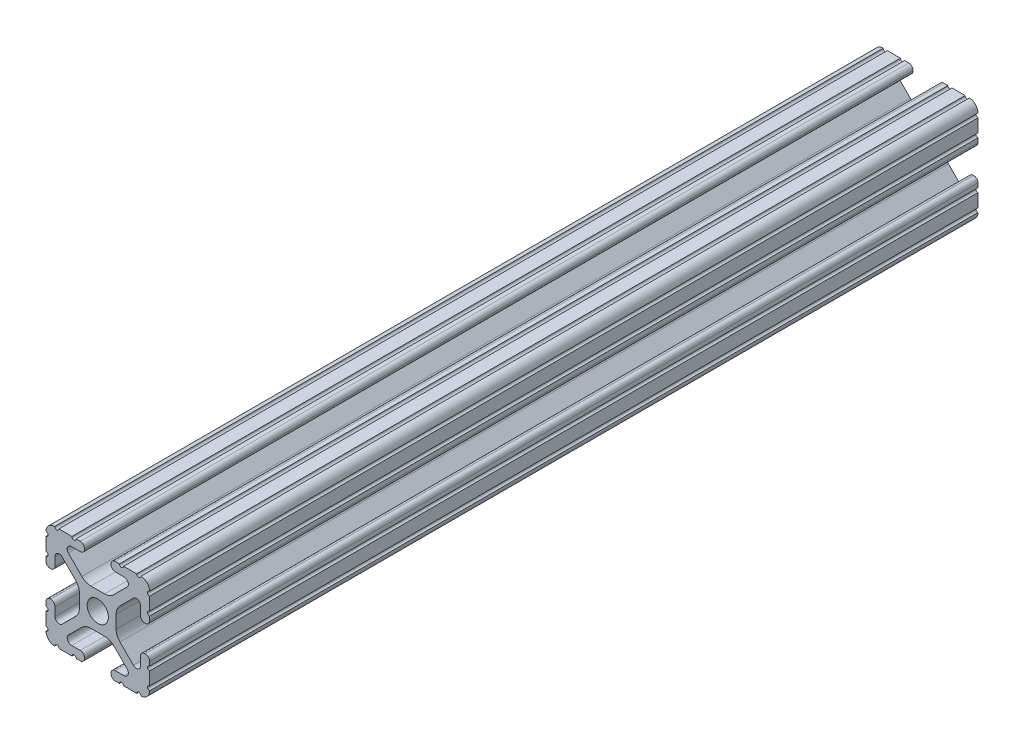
SolidWorks part; units mm, degrees
ref_plane "Front Plane" through (0, 0, 0) normal (0, 0, 1) x (1, 0, 0)
ref_plane "Top Plane" through (0, 0, 0) normal (0, 1, 0) x (1, 0, 0)
ref_plane "Right Plane" through (0, 0, 0) normal (1, 0, 0) x (0, 0, -1)
sketch "Sketch1" plane through (0, 0, 0) normal (0, 0, 1) x (1, 0, 0)
  line L88 (-7.1797, -8.6452) -> (-3.9523, -5.4237)
  line L89 (-1.7093, -4.4958) -> (1.7093, -4.4958)
  line L90 (3.9523, -5.4237) -> (7.1797, -8.6452)
  line L91 (6.4164, -10.4902) -> (4.2875, -10.4902)
  line L92 (3.2385, -11.5392) -> (3.2385, -11.651)
  line L93 (4.2875, -12.7) -> (5.3171, -12.7)
  line L94 (6.3331, -12.7) -> (9.5504, -12.7)
  line L95 (12.7, -9.5504) -> (12.7, -6.3331)
  line L96 (12.7, -5.3171) -> (12.7, -4.2875)
  line L97 (11.651, -3.2385) -> (11.5392, -3.2385)
  line L98 (10.4902, -4.2875) -> (10.4902, -6.4021)
  line L99 (8.7371, -7.1294) -> (5.441, -3.8408)
  line L100 (4.5085, -1.5932) -> (4.5085, 1.5932)
  line L101 (5.441, 3.8408) -> (8.7371, 7.1294)
  line L102 (10.4902, 6.4021) -> (10.4902, 4.2875)
  line L103 (11.5392, 3.2385) -> (11.651, 3.2385)
  line L104 (12.7, 4.2875) -> (12.7, 5.3171)
  line L105 (12.7, 6.3331) -> (12.7, 9.5504)
  line L106 (9.5504, 12.7) -> (6.3331, 12.7)
  line L107 (5.3171, 12.7) -> (4.2875, 12.7)
  line L108 (3.2385, 11.651) -> (3.2385, 11.5392)
  line L109 (4.2875, 10.4902) -> (6.4768, 10.4902)
  line L110 (7.207, 8.7244) -> (3.8983, 5.4232)
  line L111 (1.6558, 4.4958) -> (-1.6558, 4.4958)
  line L112 (-3.8983, 5.4232) -> (-7.207, 8.7244)
  line L113 (-6.4768, 10.4902) -> (-4.2875, 10.4902)
  line L114 (-3.2385, 11.5392) -> (-3.2385, 11.651)
  line L115 (-4.2875, 12.7) -> (-5.3171, 12.7)
  line L116 (-6.3331, 12.7) -> (-9.5504, 12.7)
  line L117 (-12.7, 9.5504) -> (-12.7, 6.3331)
  line L118 (-12.7, 5.3171) -> (-12.7, 4.2875)
  line L119 (-11.651, 3.2385) -> (-11.5392, 3.2385)
  line L120 (-10.4902, 4.2875) -> (-10.4902, 6.4021)
  line L121 (-8.7371, 7.1294) -> (-5.441, 3.8408)
  line L122 (-4.5085, 1.5932) -> (-4.5085, -1.5932)
  line L123 (-5.441, -3.8408) -> (-8.7371, -7.1294)
  line L124 (-10.4902, -6.4021) -> (-10.4902, -4.2875)
  line L125 (-11.5392, -3.2385) -> (-11.651, -3.2385)
  line L126 (-12.7, -4.2875) -> (-12.7, -5.3171)
  line L127 (-12.7, -6.3331) -> (-12.7, -9.5504)
  line L128 (-9.5504, -12.7) -> (-6.3331, -12.7)
  line L129 (-5.3171, -12.7) -> (-4.2875, -12.7)
  line L130 (-3.2385, -11.651) -> (-3.2385, -11.5392)
  line L131 (-4.2875, -10.4902) -> (-6.4164, -10.4902)
  circle A1 centre (0, 0) radius 2.6035
  arc A104 (-7.1797, -8.6452) -> (-6.4164, -10.4902) centre (-6.4164, -9.4098) ccw
  arc A105 (-1.7093, -4.4958) -> (-3.9523, -5.4237) centre (-1.7093, -7.6708) ccw
  arc A106 (3.9523, -5.4237) -> (1.7093, -4.4958) centre (1.7093, -7.6708) ccw
  arc A107 (6.4164, -10.4902) -> (7.1797, -8.6452) centre (6.4164, -9.4098) ccw
  arc A108 (4.2875, -10.4902) -> (3.2385, -11.5392) centre (4.2875, -11.5392) ccw
  arc A109 (3.2385, -11.651) -> (4.2875, -12.7) centre (4.2875, -11.651) ccw
  arc A110 (6.3331, -12.7) -> (5.3171, -12.7) centre (5.8251, -12.7) ccw
  arc A111 (10.5664, -12.6998) -> (9.5504, -12.7) centre (10.0584, -12.7) ccw
  arc A112 (10.5664, -12.6998) -> (12.6998, -10.5664) centre (10.5918, -10.5918) ccw
  arc A113 (12.7, -9.5504) -> (12.6998, -10.5664) centre (12.7, -10.0584) ccw
  arc A114 (12.7, -5.3171) -> (12.7, -6.3331) centre (12.7, -5.8251) ccw
  arc A115 (12.7, -4.2875) -> (11.651, -3.2385) centre (11.651, -4.2875) ccw
  arc A116 (11.5392, -3.2385) -> (10.4902, -4.2875) centre (11.5392, -4.2875) ccw
  arc A117 (8.7371, -7.1294) -> (10.4902, -6.4021) centre (9.4628, -6.4021) ccw
  arc A118 (4.5085, -1.5932) -> (5.441, -3.8408) centre (7.6835, -1.5932) ccw
  arc A119 (5.441, 3.8408) -> (4.5085, 1.5932) centre (7.6835, 1.5932) ccw
  arc A120 (10.4902, 6.4021) -> (8.7371, 7.1294) centre (9.4628, 6.4021) ccw
  arc A121 (10.4902, 4.2875) -> (11.5392, 3.2385) centre (11.5392, 4.2875) ccw
  arc A122 (11.651, 3.2385) -> (12.7, 4.2875) centre (11.651, 4.2875) ccw
  arc A123 (12.7, 6.3331) -> (12.7, 5.3171) centre (12.7, 5.8251) ccw
  arc A124 (12.6998, 10.5664) -> (12.7, 9.5504) centre (12.7, 10.0584) ccw
  arc A125 (12.6998, 10.5664) -> (10.5664, 12.6998) centre (10.5918, 10.5918) ccw
  arc A126 (9.5504, 12.7) -> (10.5664, 12.6998) centre (10.0584, 12.7) ccw
  arc A127 (5.3171, 12.7) -> (6.3331, 12.7) centre (5.8251, 12.7) ccw
  arc A128 (4.2875, 12.7) -> (3.2385, 11.651) centre (4.2875, 11.651) ccw
  arc A129 (3.2385, 11.5392) -> (4.2875, 10.4902) centre (4.2875, 11.5392) ccw
  arc A130 (7.207, 8.7244) -> (6.4768, 10.4902) centre (6.4768, 9.4563) ccw
  arc A131 (1.6558, 4.4958) -> (3.8983, 5.4232) centre (1.6558, 7.6708) ccw
  arc A132 (-3.8983, 5.4232) -> (-1.6558, 4.4958) centre (-1.6558, 7.6708) ccw
  arc A133 (-6.4768, 10.4902) -> (-7.207, 8.7244) centre (-6.4768, 9.4563) ccw
  arc A134 (-4.2875, 10.4902) -> (-3.2385, 11.5392) centre (-4.2875, 11.5392) ccw
  arc A135 (-3.2385, 11.651) -> (-4.2875, 12.7) centre (-4.2875, 11.651) ccw
  arc A136 (-6.3331, 12.7) -> (-5.3171, 12.7) centre (-5.8251, 12.7) ccw
  arc A137 (-10.5664, 12.6998) -> (-9.5504, 12.7) centre (-10.0584, 12.7) ccw
  arc A138 (-10.5664, 12.6998) -> (-12.6998, 10.5664) centre (-10.5918, 10.5918) ccw
  arc A139 (-12.7, 9.5504) -> (-12.6998, 10.5664) centre (-12.7, 10.0584) ccw
  arc A140 (-12.7, 5.3171) -> (-12.7, 6.3331) centre (-12.7, 5.8251) ccw
  arc A141 (-12.7, 4.2875) -> (-11.651, 3.2385) centre (-11.651, 4.2875) ccw
  arc A142 (-11.5392, 3.2385) -> (-10.4902, 4.2875) centre (-11.5392, 4.2875) ccw
  arc A143 (-8.7371, 7.1294) -> (-10.4902, 6.4021) centre (-9.4628, 6.4021) ccw
  arc A144 (-4.5085, 1.5932) -> (-5.441, 3.8408) centre (-7.6835, 1.5932) ccw
  arc A145 (-5.441, -3.8408) -> (-4.5085, -1.5932) centre (-7.6835, -1.5932) ccw
  arc A146 (-10.4902, -6.4021) -> (-8.7371, -7.1294) centre (-9.4628, -6.4021) ccw
  arc A147 (-10.4902, -4.2875) -> (-11.5392, -3.2385) centre (-11.5392, -4.2875) ccw
  arc A148 (-11.651, -3.2385) -> (-12.7, -4.2875) centre (-11.651, -4.2875) ccw
  arc A149 (-12.7, -6.3331) -> (-12.7, -5.3171) centre (-12.7, -5.8251) ccw
  arc A150 (-12.6998, -10.5664) -> (-12.7, -9.5504) centre (-12.7, -10.0584) ccw
  arc A151 (-12.6998, -10.5664) -> (-10.5664, -12.6998) centre (-10.5918, -10.5918) ccw
  arc A152 (-9.5504, -12.7) -> (-10.5664, -12.6998) centre (-10.0584, -12.7) ccw
  arc A153 (-5.3171, -12.7) -> (-6.3331, -12.7) centre (-5.8251, -12.7) ccw
  arc A154 (-4.2875, -12.7) -> (-3.2385, -11.651) centre (-4.2875, -11.651) ccw
  arc A155 (-3.2385, -11.5392) -> (-4.2875, -10.4902) centre (-4.2875, -11.5392) ccw
extrude "Boss-Extrude1" add sketch "Sketch1" along normal mid plane 203.2
